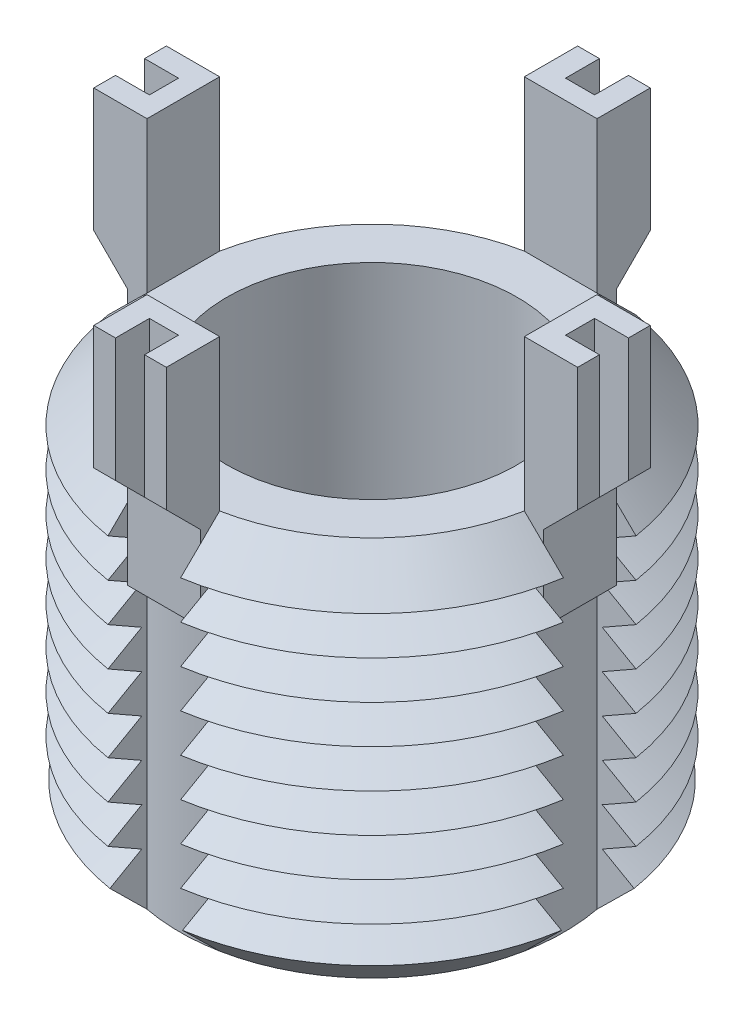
SolidWorks part; units mm, degrees
ref_plane "Front Plane" through (0, 0, 0) normal (0, 0, 1) x (1, 0, 0)
ref_plane "Top Plane" through (0, 0, 0) normal (0, 1, 0) x (1, 0, 0)
ref_plane "Right Plane" through (0, 0, 0) normal (1, 0, 0) x (0, 0, -1)
sketch "Sketch1" plane through (0, 0, 0) normal (0, 1, 0) x (1, 0, 0)
  circle A0 centre (0, 0) radius 9.525
  dimension "D1" = 19.05
extrude "Boss-Extrude1" add sketch "Sketch1" against normal blind 15.748
chamfer "Chamfer1" distance 1.587 angle 45 2 edges at (0, -15.748, 9.525) (0, 0, 9.525)
sketch "Sketch2" plane through (0, 0, 0) normal (1, 0, 0) x (0, 0, -1)
  line L0 (0, 0.8859) -> (0, -9.2617) construction
sketch "Sketch3" plane through (0, 0, 0) normal (1, 0, 0) x (0, 0, -1)
  line L0 (-9.525, -1.587) -> (-8.1506, -2.3805)
  line L1 (-8.1506, -2.3805) -> (-9.525, -3.174)
  line L2 (-9.525, -1.587) -> (-9.525, -14.161) construction
  line L3 (-9.525, -3.174) -> (-9.525, -1.587)
  dimension "D1" = 1.587
revolve "Cut-Revolve1" cut sketch "Sketch3" angle 360 about L0
pattern_linear "LPattern1" count 8 spacing 1.587 along (0, -1, 0) of "Cut-Revolve1"
sketch "Sketch4" plane through (0, 0, 0) normal (0, 1, 0) x (1, 0, 0)
  line L0 (-7.795, 1.5) -> (-9.4061, 1.5)
  line L2 (-9.4061, -1.5) -> (-7.795, -1.5)
  arc A0 (-7.795, 1.5) -> (-7.795, -1.5) centre (0, 0) ccw
  arc A1 (-9.4061, 1.5) -> (-9.4061, -1.5) centre (0, 0) ccw
  circle A2 centre (0, 0) radius 9.525 construction
  circle A3 centre (0, 0) radius 7.938 construction
  point P1 (-7.938, 0)
  point P3 (-9.525, 0)
  point P13 (0, 0)
  dimension "D1" = 3
extrude "Cut-Extrude1" cut sketch "Sketch4" against normal up to surface (15.748 mm away)
pattern_circular "CirPattern1" count 4 over 360 about axis through (0, 0, 0) along (0, 1, 0) of "Cut-Extrude1"
sketch "Sketch5" plane through (0, 0, 0) normal (1, 0, 0) x (0, 0, -1)
  line L0 (-7.795, 6.239) -> (-7.795, -3.761)
  line L1 (-7.795, -3.761) -> (-8.595, -3.761)
  line L2 (-8.595, -3.761) -> (-8.595, -0.261)
  line L3 (-8.595, -0.261) -> (-9.995, 1.139)
  line L4 (-9.995, 1.139) -> (-9.995, 6.239)
  line L5 (-9.995, 6.239) -> (-7.795, 6.239)
  line L6 (-9.4061, -4.761) -> (-1.5, -4.761) construction
  point P9 (-1.5, 0)
  point P10 (-8.595, -0.261)
  dimension "D1" = 1
  dimension "D2" = 10
  dimension "D3" = 6.5
  dimension "D4" = 2.2
  dimension "D5" = 0.8
  dimension "D6" = 45
extrude "Boss-Extrude3" add sketch "Sketch5" along normal mid plane 3
pattern_circular "CirPattern2" count 4 over 360 about axis through (0, 0, 0) along (0, 1, 0) of "Boss-Extrude3"
sketch "Sketch6" plane through (0, 6.239, 0) normal (0, 1, 0) x (1, 0, 0)
  line L0 (-9.995, -1.5) -> (-9.995, 1.5) construction
  line L1 (-9.995, -0.6) -> (-8.595, -0.6)
  line L2 (-9.995, -0.6) -> (-9.995, 0.6)
  line L3 (-9.995, 0.6) -> (-8.595, 0.6)
  line L4 (-8.595, -0.6) -> (-8.595, 0.6)
  line L5 (-9.995, -0.6) -> (-8.595, 0.6) construction
  line L6 (-9.995, 0.6) -> (-8.595, -0.6) construction
  line L7 (9.995, 1.5) -> (9.995, -1.5) construction
  line L8 (-0.6, 8.595) -> (0.6, 8.595)
  line L9 (-0.6, 8.595) -> (-0.6, 9.995)
  line L10 (-0.6, 9.995) -> (0.6, 9.995)
  line L11 (0.6, 8.595) -> (0.6, 9.995)
  line L12 (-0.6, 8.595) -> (0.6, 9.995) construction
  line L13 (-0.6, 9.995) -> (0.6, 8.595) construction
  line L14 (8.595, -0.6) -> (9.995, -0.6)
  line L15 (8.595, -0.6) -> (8.595, 0.6)
  line L16 (8.595, 0.6) -> (9.995, 0.6)
  line L17 (9.995, -0.6) -> (9.995, 0.6)
  line L18 (8.595, -0.6) -> (9.995, 0.6) construction
  line L19 (8.595, 0.6) -> (9.995, -0.6) construction
  line L20 (-0.6, -9.995) -> (0.6, -9.995)
  line L21 (-0.6, -9.995) -> (-0.6, -8.595)
  line L22 (-0.6, -8.595) -> (0.6, -8.595)
  line L23 (0.6, -9.995) -> (0.6, -8.595)
  line L24 (-0.6, -9.995) -> (0.6, -8.595) construction
  line L25 (-0.6, -8.595) -> (0.6, -9.995) construction
  line L26 (-1.5, 9.995) -> (1.5, 9.995) construction
  line L27 (1.5, -9.995) -> (-1.5, -9.995) construction
  point P0 (-9.295, 0)
  point P7 (-9.995, 0)
  point P8 (-9.995, 0)
  point P9 (0, 9.295)
  point P14 (9.295, 0)
  point P19 (0, -9.295)
  point P24 (0, 9.995)
  point P25 (9.995, 0)
  point P26 (9.995, 0)
  point P27 (0, 9.995)
  point P30 (0, -9.995)
  point P33 (0, -9.995)
  dimension "D1" = 1.2
  dimension "D2" = 1.4
extrude "Cut-Extrude3" cut sketch "Sketch6" against normal up to surface (5.1 mm away)
sketch "Sketch7" plane through (0, 0, 0) normal (0, 1, 0) x (1, 0, 0)
  circle A0 centre (0, 0) radius 6
  dimension "D1" = 12
extrude "Cut-Extrude4" cut sketch "Sketch7" against normal up to surface (15.748 mm away)
